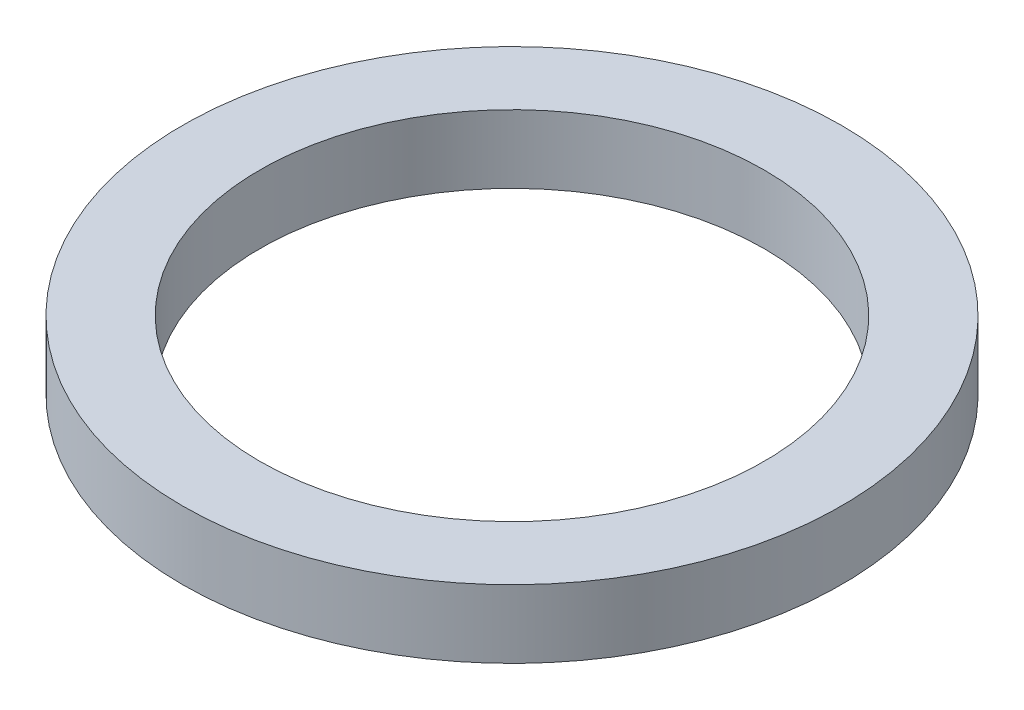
SolidWorks part; units mm, degrees
ref_plane "前基準面" through (0, 0, 0) normal (0, 0, 1) x (1, 0, 0)
ref_plane "上基準面" through (0, 0, 0) normal (0, 1, 0) x (1, 0, 0)
ref_plane "右基準面" through (0, 0, 0) normal (1, 0, 0) x (0, 0, -1)
sketch "草圖2" plane through (0, 0, 0) normal (1, 0, 0) x (0, 0, -1)
  line L0 (0, 18.8489) -> (0, -18.8489) construction
  line L2 (11.1, 0) -> (14.5, 0)
  line L3 (11.1, 0) -> (11.1, -3)
  line L4 (11.1, -3) -> (14.5, -3)
  line L5 (14.5, 0) -> (14.5, -3)
  dimension "D1" = 22.2
  dimension "D2" = 29
  dimension "D3" = 3
revolve "旋轉1" add sketch "草圖2" angle 360 about L0
